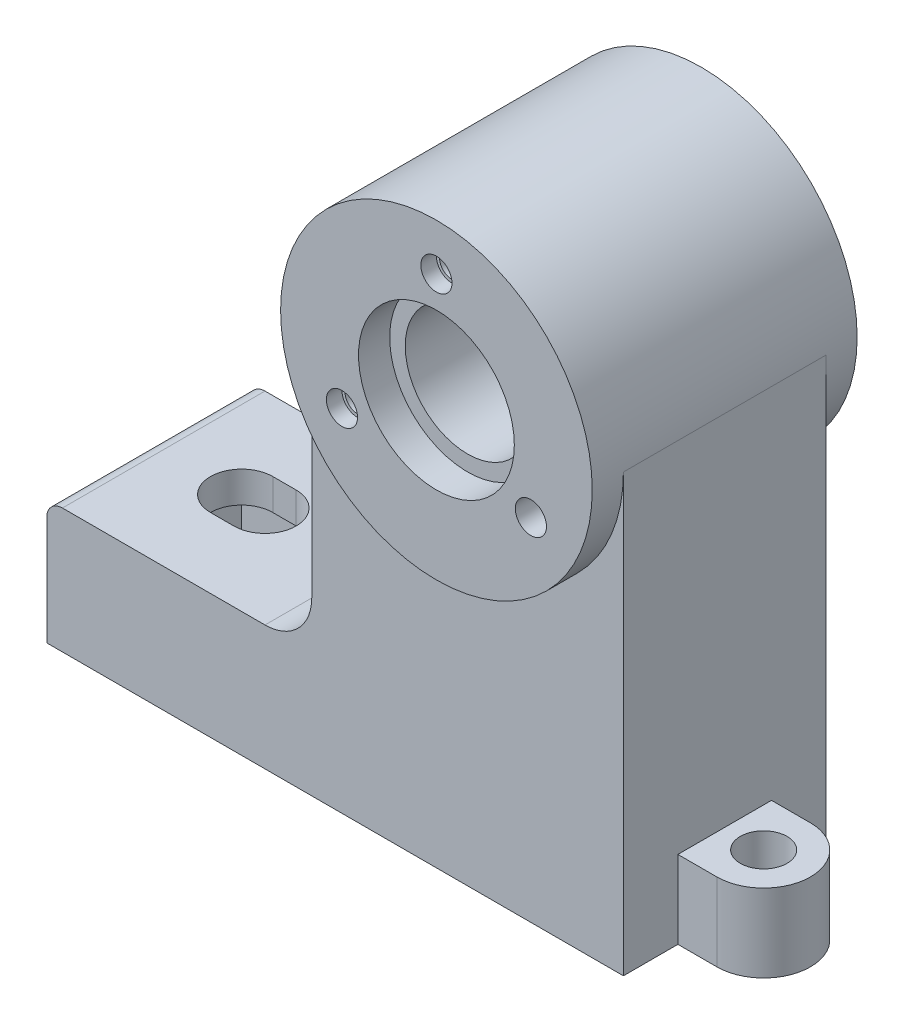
SolidWorks part; units mm, degrees
ref_plane "前视基准面" through (0, 0, 0) normal (0, 0, 1) x (1, 0, 0)
ref_plane "上视基准面" through (0, 0, 0) normal (0, 1, 0) x (1, 0, 0)
ref_plane "右视基准面" through (0, 0, 0) normal (1, 0, 0) x (0, 0, -1)
sketch "草图1" plane through (0, 0, 0) normal (0, 0, 1) x (1, 0, 0)
  circle A0 centre (0, 0) radius 4
  circle A1 centre (0, 0) radius 10
extrude "拉伸1" add sketch "草图1" along normal mid plane 17
sketch "草图2" plane through (0, 0, 0) normal (0, 0, 1) x (1, 0, 0)
  line L0 (-10, 0) -> (-10, -17)
  line L1 (-13, -20) -> (-27, -20)
  line L2 (-27, -20) -> (-27, -28)
  line L3 (-27, -28) -> (10, -28)
  line L4 (10, -28) -> (10, 0)
  circle A0 centre (0, 0) radius 10 construction
  arc A1 (-10, -17) -> (-13, -20) centre (-13, -17) cw
  arc A2 (-10, 0) -> (10, 0) centre (0, 0) ccw
  dimension "D4" = 3
  dimension "D1" = 28
  dimension "D2" = 37
  dimension "D3" = 8
extrude "拉伸2" add sketch "草图2" along normal mid plane 13
sketch "草图3" plane through (-27, 0, 0) normal (-1, 0, 0) x (0, 0, 1)
  line L0 (0, -28) -> (0, -11.9832) construction
  line L1 (6.5, -28) -> (-6.5, -28) construction
  line L2 (-3, -28) -> (-3, -26)
  line L3 (3, -26) -> (3, -28)
  line L4 (-3, -28) -> (-2, -28)
  line L5 (-2, -28) -> (-2, -26)
  line L6 (2, -26) -> (2, -28)
  line L7 (2, -28) -> (3, -28)
  arc A0 (-3, -26) -> (3, -26) centre (0, -26) cw
  arc A1 (2, -26) -> (-2, -26) centre (0, -26) ccw
extrude "拉伸3" add sketch "草图3" along normal blind 2
sketch "草图4" plane through (0, -28, 0) normal (0, -1, 0) x (1, 0, 0)
  line L0 (10, 0) -> (26.5317, 0) construction
  line L1 (10, 6.5) -> (10, -6.5) construction
  line L2 (10, 3.0037) -> (12.5, 3.0037)
  line L3 (12.5, -3.0037) -> (10, -3.0037)
  line L4 (10, -3.0037) -> (10, 3.0037)
  arc A0 (12.5, 3.0037) -> (12.5, -3.0037) centre (12.5, 0) cw
  circle A1 centre (12.5, 0) radius 1.5
  dimension "D1" = 2.5
extrude "拉伸4" add sketch "草图4" against normal blind 5
sketch "草图5" plane through (0, 0, 0) normal (0, 0, 1) x (1, 0, 0)
  line L0 (-25, -28) -> (-25, -22)
  line L1 (-27, -28) -> (10, -28) construction
  line L2 (-25, -22) -> (-13, -22)
  line L3 (-8, -17) -> (-8, -7.5498)
  line L4 (8, -7.5498) -> (8, -28)
  line L5 (8, -28) -> (-25, -28)
  line L6 (-29, -23) -> (-29, -26) construction
  line L7 (10, -28) -> (10, 0) construction
  arc A0 (-13, -22) -> (-8, -17) centre (-13, -17) ccw
  arc A1 (-13, -20) -> (-10, -17) centre (-13, -17) ccw construction
  arc A2 (-8, -7.5498) -> (8, -7.5498) centre (0, 0) ccw
  dimension "D3" = 2
  dimension "D1" = 4
  dimension "D2" = 6
extrude "切除-拉伸1" cut sketch "草图5" against normal mid plane 8
sketch "草图6" plane through (-27, 0, 0) normal (-1, 0, 0) x (0, 0, 1)
  line L0 (2, -26) -> (2, -28)
  line L1 (2, -28) -> (-2, -28)
  line L2 (-2, -28) -> (-2, -26)
  arc A0 (2, -26) -> (-2, -26) centre (0, -26) ccw
extrude "切除-拉伸2" cut sketch "草图6" against normal up to next
sketch "草图7" plane through (0, -20, 0) normal (0, 1, 0) x (1, 0, 0)
  line L0 (-21, 2) -> (-19.5, 2)
  line L1 (-19.5, -2) -> (-21, -2)
  line L2 (0, 0) -> (-17.05, 0) construction
  line L3 (-27, -6.5) -> (-27, 6.5) construction
  arc A0 (-19.5, 2) -> (-19.5, -2) centre (-19.5, 0) cw
  arc A1 (-21, -2) -> (-21, 2) centre (-21, 0) cw
  point P9 (-27, 0)
  dimension "D2" = 6
  dimension "D1" = 1.5
extrude "切除-拉伸3" cut sketch "草图7" against normal up to next
fillet "圆角1" radius 1 2 edges at (-25, -22, 0) (-27, -20, 0)
sketch "草图8" plane through (0, 0, 8.5) normal (0, 0, 1) x (1, 0, 0)
  circle A0 centre (0, 0) radius 5
extrude "切除-拉伸4" cut sketch "草图8" against normal blind 2
sketch "草图9" plane through (0, 0, -8.5) normal (0, 0, -1) x (-1, 0, 0)
  circle A0 centre (0, 0) radius 5
extrude "切除-拉伸5" cut sketch "草图9" against normal blind 4
sketch "草图10" plane through (0, 0, 8.5) normal (0, 0, 1) x (1, 0, 0)
  line L0 (0, 0) -> (0, 13.3744) construction
  line L1 (0, 0) -> (14.1526, -8.171) construction
  line L2 (0, 0) -> (-16.0701, -9.2781) construction
  point P6 (0, 7)
  point P7 (6.0622, -3.5)
  point P8 (-6.0622, -3.5)
  dimension "D1" = 120
  dimension "D2" = 120
hole_wizard "M2 螺纹孔1" positions "3D草图1" profile "草图11" tap size "M2" standard "ISO"
sketch3d "3D草图1"
  point P0 (-6.0622, -3.5, 8.5)
  point P3 (6.0622, -3.5, 8.5)
  point P6 (0, 7, 8.5)
sketch "草图11" plane through (-6.0622, -3.5, 8.5) normal (1, 0, 0) x (0, -1, 0)
  line L0 (0, 0) -> (0, 2.6807)
  line L1 (0, 2.6807) -> (0.8, 2.2)
  line L2 (0.8, 2.2) -> (0.8, 1)
  line L3 (0.8, 1) -> (1, 1)
  line L4 (1, 1) -> (1, 0)
  line L5 (1, 0) -> (0, 0)
  line L10 (0, 2.6807) -> (-0.8, 2.2) construction
  line L11 (0, -6.35) -> (0, 107.95) construction
  dimension "蹟恇謂郰芛眻噤" = 1.6
  dimension "蹟恇謂郰芛旮僅" = 2.2
  dimension "蹟恇翋眻噤" = 2
  dimension "蹟恇旮僅" = 1
  dimension "絳芛褒僅" = 118
hole_wizard "M2 螺纹孔2" positions "3D草图2" profile "草图12" tap size "M2" standard "ISO"
sketch3d "3D草图2"
  line L0 (6.0622, -3.5, 7.5) -> (6.0622, -3.5, 8.5) construction
  point P0 (6.0622, -3.5, 5.8193)
  point P3 (6.0622, -3.5, 7.5)
  point P7 (0, 7, 5.8193)
  point P10 (-6.0622, -3.5, 5.8193)
sketch "草图12" plane through (6.0622, -3.5, 7.5) normal (1, 0, 0) x (0, -1, 0)
  line L0 (0, 0) -> (0, 2.6807)
  line L1 (0, 2.6807) -> (0.8, 2.2)
  line L2 (0.8, 2.2) -> (0.8, 1)
  line L3 (0.8, 1) -> (1, 1)
  line L4 (1, 1) -> (1, 0)
  line L5 (1, 0) -> (0, 0)
  line L10 (0, 2.6807) -> (-0.8, 2.2) construction
  line L11 (0, -6.35) -> (0, 107.95) construction
  dimension "蹟恇謂郰芛眻噤" = 1.6
  dimension "蹟恇謂郰芛旮僅" = 2.2
  dimension "蹟恇翋眻噤" = 2
  dimension "蹟恇旮僅" = 1
  dimension "絳芛褒僅" = 118
sketch "草图16" plane through (0, 0, -8.5) normal (0, 0, -1) x (-1, 0, 0)
  point P0 (6.0622, -3.5)
  point P1 (-6.0622, -3.5)
  point P3 (0, 7)
hole_wizard "M2 螺纹孔3" positions "3D草图4" profile "草图17" tap size "M2" standard "ISO"
sketch3d "3D草图4"
  point P0 (0, 7, 5.8193)
  point P3 (6.0622, -3.5, 4.8193)
  point P6 (-6.0622, -3.5, 5.8193)
  point P10 (-6.0622, -3.5, -8.5)
  point P13 (6.0622, -3.5, -8.5)
  point P16 (0, 7, -8.5)
sketch "草图17" plane through (-6.0622, -3.5, -8.5) normal (1, 0, 0) x (0, 1, 0)
  line L0 (0, 0) -> (0, 2.6807)
  line L1 (0, 2.6807) -> (0.8, 2.2)
  line L2 (0.8, 2.2) -> (0.8, 1)
  line L3 (0.8, 1) -> (1, 1)
  line L4 (1, 1) -> (1, 0)
  line L5 (1, 0) -> (0, 0)
  line L10 (0, 2.6807) -> (-0.8, 2.2) construction
  line L11 (0, -6.35) -> (0, 107.95) construction
  dimension "蹟恇謂郰芛眻噤" = 1.6
  dimension "蹟恇謂郰芛旮僅" = 2.2
  dimension "蹟恇翋眻噤" = 2
  dimension "蹟恇旮僅" = 1
  dimension "絳芛褒僅" = 118
